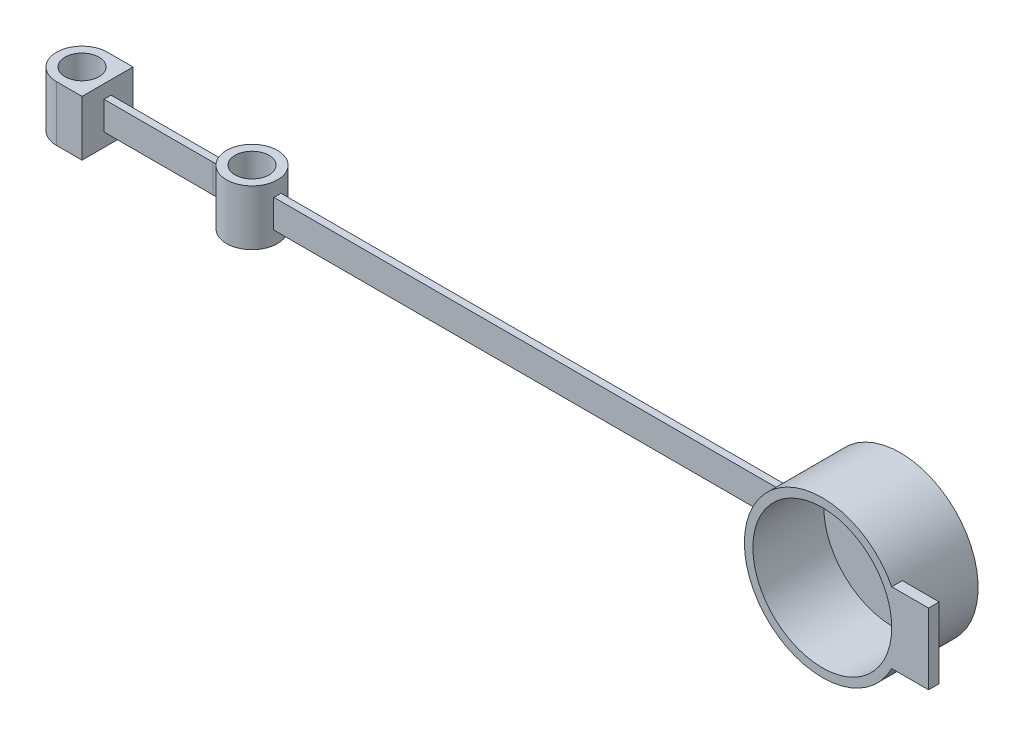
SolidWorks part; units mm, degrees
ref_plane "Front Plane" through (0, 0, 0) normal (0, 0, 1) x (1, 0, 0)
ref_plane "Top Plane" through (0, 0, 0) normal (0, 1, 0) x (1, 0, 0)
ref_plane "Right Plane" through (0, 0, 0) normal (1, 0, 0) x (0, 0, -1)
sketch "Sketch6" plane through (0, 0, 0) normal (0, 1, 0) x (1, 0, 0)
  line L0 (0, 0) -> (-24, 0) construction
  line L1 (88, 0.5) -> (0, 0.5)
  line L3 (0, 0) -> (88, 0) construction
  line L5 (0, 0) -> (0, 0.5) construction
  line L6 (-24, 0.5) -> (-24, -0.5)
  line L9 (88, 0.5) -> (88, -0.5)
  line L12 (0, 0.5) -> (-24, 0.5)
  line L14 (88, -0.5) -> (0, -0.5)
  line L15 (0, -0.5) -> (-24, -0.5)
  dimension "D1" = 0.5
  dimension "D2" = 24
  dimension "D5" = 88
extrude "Boss-Extrude2" add sketch "Sketch6" along normal mid plane 4
sketch "Sketch12" plane through (0, 0, 0) normal (0, 1, 0) x (1, 0, 0)
  line L0 (-24, 0.5) -> (-24, -0.5) construction
  line L1 (-24, 3.6) -> (-20.4, 3.6)
  line L2 (-20.4, 3.6) -> (-20.4, -3.6)
  line L3 (-20.4, -3.6) -> (-24, -3.6)
  circle A0 centre (0, 0) radius 3.6
  arc A1 (-24, 3.6) -> (-24, -3.6) centre (-24, 0) ccw
  dimension "D1" = 7.2
  dimension "D2" = 7.2
  dimension "D3" = 3.6
  dimension "D4" = 3.6
extrude "Boss-Extrude3" add sketch "Sketch12" along normal mid plane 7.8
sketch "Sketch13" plane through (0, 3.9, 0) normal (0, 1, 0) x (1, 0, 0)
  circle A0 centre (-24, 0) radius 2.4
  circle A1 centre (0, 0) radius 2.4
  dimension "D1" = 4.8
  dimension "D2" = 4.8
extrude "Cut-Extrude2" cut sketch "Sketch13" against normal through all
sketch "Sketch10" plane through (0, 0, 0) normal (0, -1, 0) x (1, 0, 0)
  line L0 (77, 7.5) -> (77, -3.5)
  line L1 (77, -3.5) -> (88, -3.5)
  line L2 (88, -3.5) -> (88, 7.5)
  line L3 (88, 7.5) -> (77, 7.5)
  line L9 (0, 0) -> (154, 0) construction
  dimension "D1" = 88
  dimension "D2" = 11
  dimension "D3" = 3.5
  dimension "D4" = 11
revolve "Revolve1" add sketch "Sketch10" angle 360 about L2
ref_plane "Sketch Plane" through (100, 0, 0) normal (1, 0, 0) x (0, 0, -1)
sketch "Sketch20" plane through (100, 0, 0) normal (1, 0, 0) x (0, 0, -1)
  line L0 (0, 0) -> (-7.5, 0) construction
  line L1 (-7.5, -5) -> (-7.5, 5)
  line L3 (-7.5, 5) -> (-6, 5)
  line L4 (-6, 5) -> (-6, -5)
  line L5 (-7.5, -5) -> (-6, -5)
  line L6 (-7.5, 11) -> (-7.5, -11) construction
  point P10 (-6, 0)
  point P11 (-7.5, 0)
  dimension "D1" = 5
  dimension "D2" = 1.5
extrude "Boss-Extrude5" add sketch "Sketch20" along normal blind 3 and the other way up to surface
sketch "Sketch8" plane through (0, 0, 0) normal (0, 1, 0) x (1, 0, 0)
  line L0 (88, -18.7) -> (88, 7.3017) construction
  line L5 (78.2, -8.5) -> (78.2, 2.5)
  line L6 (99, 3.5) -> (77, 3.5) construction
  line L7 (78.2, 2.5) -> (88, 2.5)
  line L8 (88, 2.5) -> (88, -8.5)
  line L9 (88, -8.5) -> (78.2, -8.5)
  line L10 (77, -7.5) -> (97.798, -7.5) construction
  dimension "D1" = 88
  dimension "D2" = 1
  dimension "D3" = 9.8
  dimension "D4" = 1
revolve "Cut-Revolve2" cut sketch "Sketch8" angle 360 about L0
sketch "Reference Sketch" plane through (0, 0, 0) normal (0, 0, 1) x (1, 0, 0)
  point P0 (-10, 0)
  point P1 (10, 0)
  dimension "D1" = 10
  dimension "D2" = 10
sketch "Sketch16" plane through (0, 0, 0) normal (0, 0, 1) x (1, 0, 0)
  line L0 (-5, 2) -> (-5, -2)
  line L1 (-20.4, 2) -> (-3.5651, 2) construction
  line L2 (-20.4, -2) -> (-3.5651, -2) construction
  dimension "D1" = 5
sketch "Sketch17" plane through (0, 0, 0) normal (0, -1, 0) x (1, 0, 0)
  line L0 (-5, 0.5) -> (-5, -0.5)
  line L1 (-3.5651, -0.5) -> (-20.4, -0.5) construction
  line L2 (-20.4, 0.5) -> (-5, 0.5) construction
  dimension "D1" = 5
sketch "Sketch18" plane through (0, 0, 0) normal (1, 0, 0) x (0, 0, -1)
  line L1 (-0.9753, -2.3079) -> (0.9753, -2.3079)
  line L2 (-0.9753, -2.3079) -> (-0.9753, 2.3079)
  line L3 (-0.9753, 2.3079) -> (0.9753, 2.3079)
  line L4 (0.9753, -2.3079) -> (0.9753, 2.3079)
  line L5 (-0.9753, -2.3079) -> (0.9753, 2.3079) construction
  line L6 (-0.9753, 2.3079) -> (0.9753, -2.3079) construction
  point P0 (0, 0)
